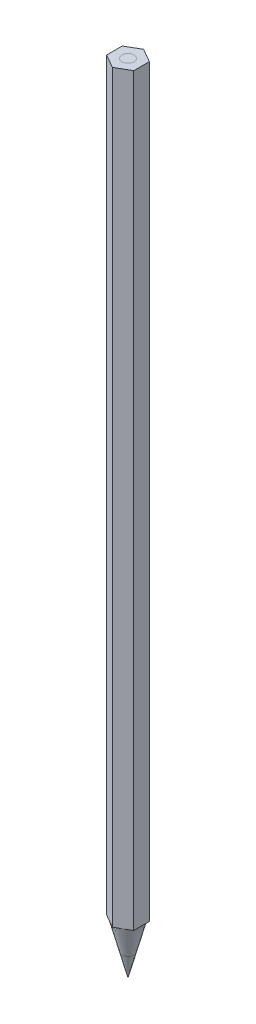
SolidWorks part; units mm, degrees
ref_plane "Plan de face" through (0, 0, 0) normal (0, 0, 1) x (1, 0, 0)
ref_plane "Plan de dessus" through (0, 0, 0) normal (0, 1, 0) x (1, 0, 0)
ref_plane "Plan de droite" through (0, 0, 0) normal (1, 0, 0) x (0, 0, -1)
sketch "Esquisse1" plane through (0, 0, 0) normal (0, 1, 0) x (1, 0, 0)
  line L1 (0, 3.926) -> (-3.4, 1.963)
  line L2 (-3.4, 1.963) -> (-3.4, -1.963)
  line L3 (-3.4, -1.963) -> (0, -3.926)
  line L4 (0, -3.926) -> (3.4, -1.963)
  line L5 (3.4, -1.963) -> (3.4, 1.963)
  line L6 (3.4, 1.963) -> (0, 3.926)
  circle A0 centre (0, 0) radius 3.4 construction
  circle A1 centre (0, 0) radius 1.5
  dimension "D2" = 3
  dimension "D1" = 6.8
extrude "Extrusion1" add sketch "Esquisse1" along normal blind 200
sketch "Esquisse2" plane through (0, 0, 0) normal (0, 1, 0) x (1, 0, 0)
  circle A0 centre (0, 0) radius 1.5
extrude "Extrusion2" add sketch "Esquisse2" along normal blind 200 separate body
sketch "Esquisse3" plane through (0, 0, 0) normal (0, 0, 1) x (1, 0, 0)
  line L0 (0, 0) -> (3.4, 13.0083)
  line L1 (3.4, 200) -> (3.4, 0) construction
  line L2 (3.4, 13.0083) -> (7.9761, 13.0083)
  line L3 (7.9761, 13.0083) -> (7.9761, -5.2709)
  line L4 (0, 0) -> (0, 16.6971) construction
  line L5 (0, 200) -> (0, 0) construction
  line L6 (7.9761, -5.2709) -> (0, -5.2709)
  line L7 (0, -5.2709) -> (0, 0)
revolve "Enlèvement de matière-Révolution2" cut sketch "Esquisse3" angle 360 about L4
